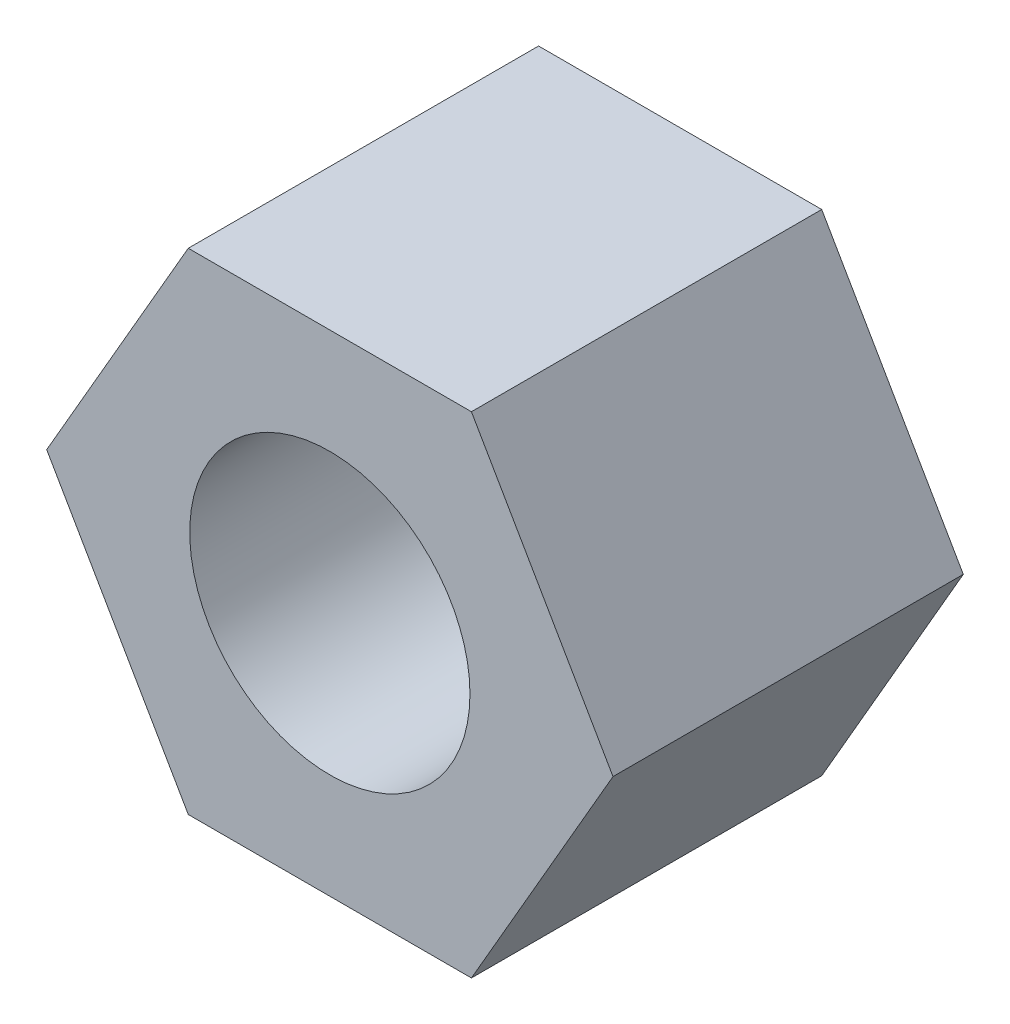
SolidWorks part; units mm, degrees
ref_plane "前视基准面" through (0, 0, 0) normal (0, 0, 1) x (1, 0, 0)
ref_plane "上视基准面" through (0, 0, 0) normal (0, 1, 0) x (1, 0, 0)
ref_plane "右视基准面" through (0, 0, 0) normal (1, 0, 0) x (0, 0, -1)
other "Configuration Table"
sketch "草图1" plane through (0, 0, 0) normal (0, 0, 1) x (1, 0, 0)
  line L0 (4.0415, 0) -> (2.0207, 3.5)
  line L1 (2.0207, 3.5) -> (-2.0207, 3.5)
  line L2 (-2.0207, 3.5) -> (-4.0415, 0)
  line L3 (-4.0415, 0) -> (-2.0207, -3.5)
  line L4 (-2.0207, -3.5) -> (2.0207, -3.5)
  line L5 (2.0207, -3.5) -> (4.0415, 0)
  circle A0 centre (0, 0) radius 2
  dimension "D1" = 4
  dimension "D2" = 2.0207
  dimension "D3" = 4.0415
  dimension "D4" = 2.0207
extrude "Nylock_external_envelope" add sketch "草图1" along normal blind 5
